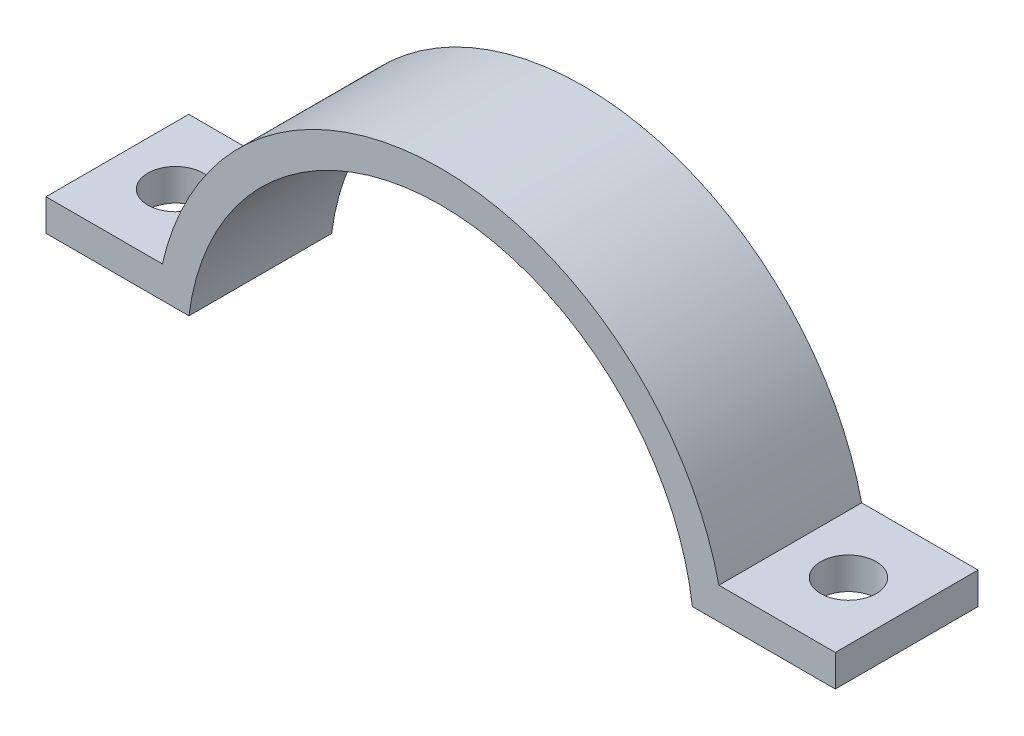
SolidWorks part; units mm, degrees
ref_plane "Front Plane" through (0, 0, 0) normal (0, 0, 1) x (1, 0, 0)
ref_plane "Top Plane" through (0, 0, 0) normal (0, 1, 0) x (1, 0, 0)
ref_plane "Right Plane" through (0, 0, 0) normal (1, 0, 0) x (0, 0, -1)
sketch "Sketch1" plane through (0, 0, 0) normal (0, 0, 1) x (1, 0, 0)
  line L0 (-17.8885, 2) -> (-15.8745, 2)
  line L1 (15.8745, 2) -> (17.8885, 2)
  line L3 (-15.8745, 2) -> (-24.8885, 2)
  line L4 (-15.8745, 2) -> (-15.8745, 4)
  line L5 (-15.8745, 4) -> (-24.8885, 4)
  line L6 (-24.8885, 2) -> (-24.8885, 4)
  line L7 (15.8745, 2) -> (24.8885, 2)
  line L8 (15.8745, 2) -> (15.8745, 4)
  line L9 (15.8745, 4) -> (24.8885, 4)
  line L10 (24.8885, 2) -> (24.8885, 4)
  arc A0 (15.8745, 2) -> (-15.8745, 2) centre (0, 0) ccw
  arc A1 (17.8885, 2) -> (-17.8885, 2) centre (0, 0) ccw
  circle A2 centre (0, 0) radius 15 construction
  point P7 (0, 0)
  dimension "D1" = 32
  dimension "D2" = 36
  dimension "D3" = 30
  dimension "D4" = 2
  dimension "D5" = 2
  dimension "D6" = 2
  dimension "D7" = 7
  dimension "D8" = 7
extrude "Boss-Extrude1" add sketch "Sketch1" along normal blind 9 contours L9 A1 L5 L4 A0 L8 | L5 A1 L0 L4 | A1 L5 L6 L3 | L1 A1 L9 L8 | A1 L7 L10 L9
sketch "Sketch2" plane through (0, 4, 0) normal (0, 1, 0) x (1, 0, 0)
  line L0 (-21.2192, 0) -> (-21.2192, -9) construction
  line L1 (-17.5499, 0) -> (-24.8885, 0) construction
  line L2 (-17.5499, -9) -> (-24.8885, -9) construction
  line L3 (21.2192, -9) -> (21.2192, 0) construction
  line L4 (17.5499, -9) -> (24.8885, -9) construction
  line L5 (17.5499, 0) -> (24.8885, 0) construction
  circle A0 centre (-21.2192, -4.5) radius 1.75
  circle A1 centre (21.2192, -4.5) radius 1.75
  dimension "D1" = 3.5
extrude "Cut-Extrude1" cut sketch "Sketch2" against normal through all
